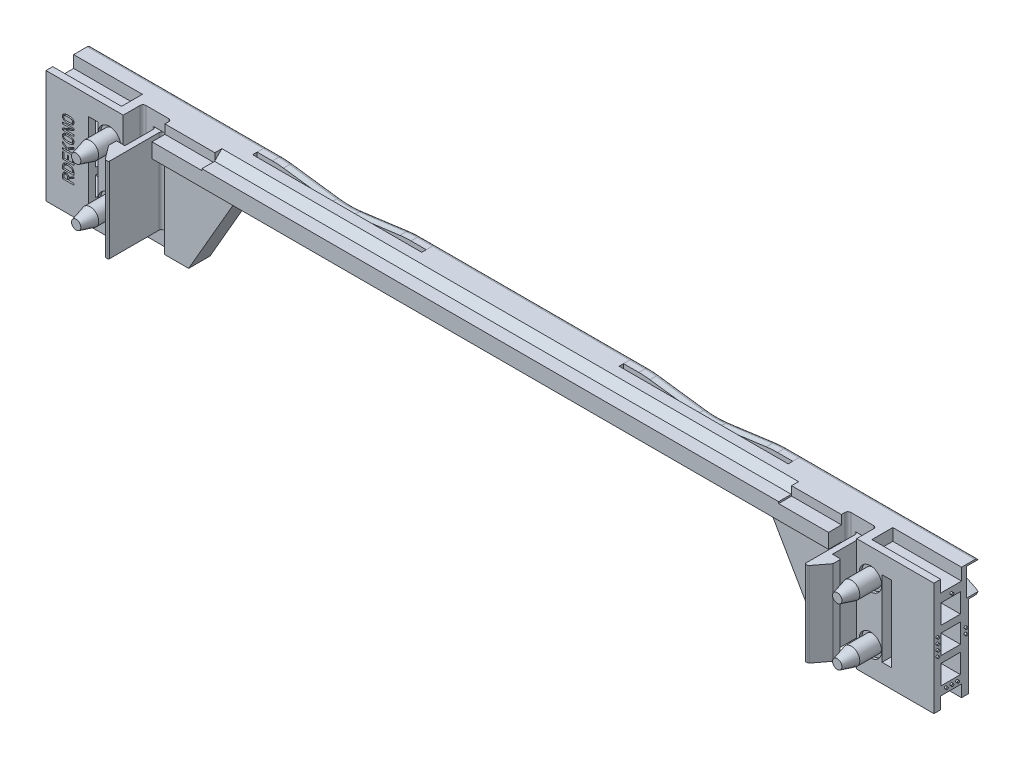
SolidWorks part; units mm, degrees
ref_plane "前视基准面" through (0, 0, 0) normal (0, 0, 1) x (1, 0, 0)
ref_plane "上视基准面" through (0, 0, 0) normal (0, 1, 0) x (1, 0, 0)
ref_plane "右视基准面" through (0, 0, 0) normal (1, 0, 0) x (0, 0, -1)
sketch "草图1" plane through (0, 0, 0) normal (0, 0, 1) x (1, 0, 0)
  line L0 (-47.35, 4.525) -> (47.35, 4.525)
  line L1 (-78.75, 10.025) -> (78.75, 10.025)
  line L2 (-78.75, 10.025) -> (-78.75, -10.025)
  line L3 (-78.75, -10.025) -> (-55.75, -10.025)
  line L4 (78.75, 10.025) -> (78.75, -10.025)
  line L5 (-78.75, 10.025) -> (78.75, -10.025) construction
  line L6 (-78.75, -10.025) -> (78.75, 10.025) construction
  line L7 (-47.35, 4.525) -> (-55.75, -10.025)
  line L8 (47.35, 4.525) -> (55.75, -10.025)
  line L9 (55.75, -10.025) -> (78.75, -10.025)
  point P0 (0, 0)
  point P8 (0, 4.525)
  dimension "D1" = 157.5
  dimension "D2" = 20.05
  dimension "D3" = 5.5
  dimension "D4" = 23
  dimension "D5" = 31.4
extrude "凸台-拉伸1" add sketch "草图1" along normal mid plane 6.1
sketch "草图2" plane through (0, -10.025, 0) normal (0, -1, 0) x (1, 0, 0)
  line L0 (-47.35, 3.05) -> (47.35, 3.05) construction
  line L1 (-65.05, 3.05) -> (65.05, 3.05)
  line L2 (-78.75, -3.05) -> (-55.75, -3.05) construction
  line L3 (-60, 0.75) -> (60, 0.75)
  line L5 (60, 0.75) -> (60, 0.05)
  line L6 (60.5, -0.45) -> (64.55, -0.45)
  line L7 (65.05, 0.05) -> (65.05, 3.05)
  line L8 (55.75, 3.05) -> (78.75, 3.05) construction
  line L9 (-60, 0.75) -> (-60, 0.05)
  line L10 (-60.5, -0.45) -> (-64.55, -0.45)
  line L11 (-65.05, 0.05) -> (-65.05, 3.05)
  line L12 (-78.75, 3.05) -> (-55.75, 3.05) construction
  line L13 (78.75, 3.05) -> (78.75, -3.05) construction
  line L15 (-47.35, -3.05) -> (47.35, -3.05) construction
  arc A0 (-60, 0.05) -> (-60.5, -0.45) centre (-60.5, 0.05) cw
  arc A1 (-64.55, -0.45) -> (-65.05, 0.05) centre (-64.55, 0.05) cw
  arc A2 (64.55, -0.45) -> (65.05, 0.05) centre (64.55, 0.05) ccw
  arc A3 (60, 0.05) -> (60.5, -0.45) centre (60.5, 0.05) ccw
  point P6 (0, 0.75)
  point P22 (-60, -0.45)
  point P25 (-65.05, -0.45)
  dimension "D7" = 0.5
  dimension "D8" = 0.5
  dimension "D1" = 3.8
  dimension "D2" = 13.7
  dimension "D3" = 120
  dimension "D6" = 2.6
extrude "切除-拉伸1" cut sketch "草图2" against normal through all
ref_plane "基准面1" through (0, -7.525, 0) normal (0, -1, 0) x (-1, 0, 0)
sketch "草图3" plane through (0, -7.525, 0) normal (0, -1, 0) x (-1, 0, 0)
  line L0 (61.75, 0.45) -> (62.75, 0.45)
  line L1 (64.55, 0.45) -> (60.5, 0.45) construction
  line L2 (62.75, 0.45) -> (62.75, -5.05)
  line L3 (62.75, -5.05) -> (64.25, -5.05)
  line L4 (64.25, -5.05) -> (64.25, -6.45)
  line L5 (64.25, -6.45) -> (62.35, -8.95)
  line L6 (62.35, -8.95) -> (61.75, -8.95)
  line L7 (61.75, -8.95) -> (61.75, 0.45)
  line L9 (78.75, 3.05) -> (55.75, 3.05) construction
  line L10 (0, 0) -> (0, -11.725) construction
  line L11 (-61.75, -8.95) -> (-61.75, 0.45)
  line L12 (-62.35, -8.95) -> (-61.75, -8.95)
  line L13 (-64.25, -6.45) -> (-62.35, -8.95)
  line L14 (-64.25, -5.05) -> (-64.25, -6.45)
  line L15 (-62.75, -5.05) -> (-64.25, -5.05)
  line L16 (-62.75, 0.45) -> (-62.75, -5.05)
  line L17 (-61.75, 0.45) -> (-62.75, 0.45)
  line L18 (65.05, -3.05) -> (78.75, -3.05) construction
  line L19 (78.75, -3.05) -> (78.75, 3.05) construction
  dimension "D1" = 1
  dimension "D2" = 14.5
  dimension "D3" = 12
  dimension "D4" = 2
  dimension "D5" = 2.5
  dimension "D6" = 9.5
  dimension "D7" = 0.6
extrude "凸台-拉伸2" add sketch "草图3" against normal blind 15
sketch "草图4" plane through (0, 0, 0.75) normal (0, 0, 1) x (1, 0, 0)
  line L0 (-60, 10.025) -> (60, 10.025) construction
  line L1 (-60, 8.725) -> (60, 8.725)
  line L2 (-60, 8.725) -> (-60, 5.825)
  line L3 (-60, 5.825) -> (60, 5.825)
  line L4 (60, 8.725) -> (60, 5.825)
  line L5 (-60, 8.725) -> (60, 5.825) construction
  line L6 (-60, 5.825) -> (60, 8.725) construction
  line L8 (-60, 10.025) -> (-60, -10.025) construction
  point P0 (0, 7.275)
  dimension "D1" = 2.9
  dimension "D2" = 1.3
extrude "凸台-拉伸3" add sketch "草图4" along normal blind 2.25
chamfer "倒角6" distance 1.3 angle 45 1 edges at (0, 4.525, 0.75)
sketch "草图17" plane through (0, 0, 3) normal (0, 0, 1) x (1, 0, 0)
  line L0 (60, 10.025) -> (60, -10.025) construction
  line L1 (60, 8.425) -> (51.15, 8.425)
  line L2 (60, 8.425) -> (60, 10.025)
  line L3 (60, 10.025) -> (51.15, 10.025)
  line L4 (51.15, 8.425) -> (51.15, 10.025)
  line L5 (-60, 10.025) -> (60, 10.025) construction
  line L6 (0, 8.725) -> (0, 15.7989) construction
  line L7 (60, 8.725) -> (-60, 8.725) construction
  line L8 (-51.15, 8.425) -> (-51.15, 10.025)
  line L9 (-60, 10.025) -> (-51.15, 10.025)
  line L10 (-60, 8.425) -> (-60, 10.025)
  line L11 (-60, 8.425) -> (-51.15, 8.425)
  dimension "D1" = 102.3
  dimension "D2" = 1.6
extrude "切除-拉伸10" cut sketch "草图17" against normal blind 2.3
sketch "草图18" plane through (51.15, 0, 0) normal (1, 0, 0) x (0, 0, -1)
  line L0 (-0.75, 10.025) -> (-0.75, 8.725)
  line L1 (-0.75, 8.725) -> (0.55, 10.025)
  line L2 (0.55, 10.025) -> (-0.75, 10.025)
extrude "切除-拉伸11" cut sketch "草图18" against normal up to surface (102.3 mm away)
sketch "草图10" plane through (0, 0, 3.05) normal (0, 0, 1) x (1, 0, 0)
  line L1 (78.75, -10.025) -> (78.75, 10.025) construction
  line L2 (0, 0) -> (0, -13.4841) construction
  circle A0 centre (67.5, 5.08) radius 1.5
  circle A1 centre (67.5, -5.08) radius 1.5
  circle A2 centre (-67.5, -5.08) radius 1.5
  circle A3 centre (-67.5, 5.08) radius 1.5
  point P4 (78.75, 0)
  dimension "D1" = 10.16
  dimension "D2" = 5.08
  dimension "D3" = 3
  dimension "D4" = 135
extrude "凸台-拉伸4" add sketch "草图10" along normal blind 5.9
sketch "草图19" plane through (0, 0, 3.05) normal (0, 0, 1) x (1, 0, 0)
  circle A0 centre (67.5, 5.08) radius 2
  circle A1 centre (67.5, -5.08) radius 2
  circle A2 centre (-67.5, 5.08) radius 2
  circle A3 centre (-67.5, -5.08) radius 2
  circle A4 centre (-67.5, -5.08) radius 1.5
  circle A5 centre (-67.5, 5.08) radius 1.5
  circle A6 centre (67.5, 5.08) radius 1.5
  circle A7 centre (67.5, -5.08) radius 1.5
  dimension "D1" = 3
  dimension "D2" = 4
extrude "切除-拉伸12" cut sketch "草图19" against normal blind 0.5
chamfer "倒角7" distance 2.5 angle 15 4 edges at (-69, 5.08, 8.95) (69, 5.08, 8.95) (69, -5.08, 8.95) (-69, -5.08, 8.95)
sketch "草图12" plane through (-78.75, 0, 0) normal (-1, 0, 0) x (0, 0, 1)
  line L0 (3.05, 10.025) -> (-3.05, 10.025) construction
  line L1 (-1.85, 10.025) -> (1.85, 10.025)
  line L2 (-1.85, 10.025) -> (-1.85, 7.9)
  line L3 (-1.85, 7.9) -> (1.85, 7.9)
  line L4 (1.85, 10.025) -> (1.85, 7.9)
  line L5 (3.05, -10.025) -> (-3.05, -10.025) construction
  line L6 (-1.85, -10.025) -> (1.85, -10.025)
  line L7 (-1.85, -10.025) -> (-1.85, -7.9)
  line L8 (-1.85, -7.9) -> (1.85, -7.9)
  line L9 (1.85, -10.025) -> (1.85, -7.9)
  line L10 (-3.05, 10.025) -> (-3.05, -10.025) construction
  line L11 (3.05, 10.025) -> (3.05, -10.025) construction
  dimension "D1" = 15.8
  dimension "D2" = 1.2
  dimension "D5" = 1.2
extrude "切除-拉伸7" cut sketch "草图12" against normal blind 12.2
sketch "草图13" plane through (-78.75, 0, 0) normal (-1, 0, 0) x (0, 0, 1)
  line L0 (-1.85, 10.025) -> (-1.85, 7.9) construction
  line L1 (-1.85, 6.375) -> (1.6, 6.375)
  line L2 (-1.85, 6.375) -> (-1.85, 2.925)
  line L3 (-1.85, 2.925) -> (1.6, 2.925)
  line L4 (1.6, 6.375) -> (1.6, 2.925)
  line L5 (-1.85, 6.375) -> (1.6, 2.925) construction
  line L6 (-1.85, 2.925) -> (1.6, 6.375) construction
  line L8 (-1.85, 1.725) -> (-1.85, -1.725)
  line L9 (-1.85, 1.725) -> (1.6, 1.725)
  line L10 (-1.85, -1.725) -> (1.6, -1.725)
  line L11 (1.6, 1.725) -> (1.6, -1.725)
  line L12 (-1.85, -2.925) -> (-1.85, -6.375)
  line L13 (-1.85, -2.925) -> (1.6, -2.925)
  line L14 (-1.85, -6.375) -> (1.6, -6.375)
  line L15 (1.6, -2.925) -> (1.6, -6.375)
  point P0 (-0.125, 4.65)
  point P7 (1.6, 0)
  dimension "D1" = 3.45
  dimension "D2" = 3.45
  dimension "D4" = 4.65
  dimension "D3" = 3
extrude "切除-拉伸8" cut sketch "草图13" against normal blind 7.8
sketch "草图30" plane through (0, 0, -3.05) normal (0, 0, -1) x (-1, 0, 0)
  line L0 (-78.75, -10.025) -> (-78.75, 10.025) construction
  line L1 (78.75, 10.025) -> (-78.75, 10.025)
  line L2 (78.75, 10.025) -> (78.75, 4.525)
  line L3 (78.75, 4.525) -> (-78.75, 4.525)
  line L4 (-78.75, 10.025) -> (-78.75, 4.525)
  line L5 (47.35, 4.525) -> (-47.35, 4.525) construction
extrude "切除-拉伸16" cut sketch "草图30" against normal blind 0.3
sketch "草图14" plane through (0, 0, -2.75) normal (0, 0, -1) x (-1, 0, 0)
  line L0 (78.75, 4.525) -> (78.75, -10.025) construction
  line L1 (-78.75, 10.025) -> (78.75, 10.025)
  line L2 (-78.75, 10.025) -> (-78.75, 8.725)
  line L3 (-78.75, 8.725) -> (78.75, 8.725)
  line L4 (78.75, 10.025) -> (78.75, 8.725)
  line L5 (-78.75, -10.025) -> (-78.75, 4.525) construction
  line L6 (-78.75, 5.825) -> (78.75, 5.825)
  line L7 (-78.75, 5.825) -> (-78.75, 4.525)
  line L8 (-78.75, 4.525) -> (78.75, 4.525)
  line L9 (78.75, 5.825) -> (78.75, 4.525)
  line L10 (47.35, 4.525) -> (-47.35, 4.525) construction
  line L13 (78.75, 4.525) -> (78.75, 10.025) construction
  line L14 (78.75, 10.025) -> (-78.75, 10.025) construction
  dimension "D1" = 1.3
  dimension "D2" = 1.3
extrude "凸台-拉伸5" add sketch "草图14" along normal blind 2.1
fillet "圆角1" radius 0.6 2 edges at (0, 4.525, -4.85) (0, 10.025, -4.85)
sketch "草图15" plane through (0, 0, -4.85) normal (0, 0, -1) x (-1, 0, 0)
  line L0 (-78.75, 10.025) -> (78.75, 10.025) construction
  line L1 (-47.5, 10.025) -> (-17.5, 10.025)
  line L2 (-47.5, 10.025) -> (-47.5, 8.725)
  line L3 (-47.5, 8.725) -> (-17.5, 8.725)
  line L4 (-17.5, 10.025) -> (-17.5, 8.725)
  line L5 (-47.5, 10.025) -> (-17.5, 8.725) construction
  line L6 (-47.5, 8.725) -> (-17.5, 10.025) construction
  line L7 (-78.75, 8.725) -> (78.75, 8.725) construction
  line L9 (17.5, 8.725) -> (47.5, 8.725)
  line L10 (17.5, 8.725) -> (17.5, 10.025)
  line L11 (17.5, 10.025) -> (47.5, 10.025)
  line L12 (47.5, 8.725) -> (47.5, 10.025)
  line L13 (17.5, 8.725) -> (47.5, 10.025) construction
  line L14 (17.5, 10.025) -> (47.5, 8.725) construction
  point P0 (-32.5, 9.375)
  point P10 (32.5, 9.375)
  dimension "D1" = 30
  dimension "D2" = 17.5
  dimension "D3" = 17.5
extrude "切除-拉伸9" cut sketch "草图15" against normal blind 2.5
sketch "草图16" plane through (0, 0, -4.85) normal (0, 0, -1) x (-1, 0, 0)
  line L0 (-44.7912, 10.025) -> (-47.5, 10.025)
  line L1 (-17.5, 10.025) -> (-47.5, 10.025) construction
  line L2 (-47.5, 10.025) -> (-47.5, 8.725)
  line L3 (-47.5, 8.725) -> (-44.9741, 8.725)
  line L4 (-47.5, 8.725) -> (-17.5, 8.725) construction
  line L5 (-20.2088, 10.025) -> (-17.5, 10.025)
  line L6 (-17.5, 10.025) -> (-17.5, 8.725)
  line L7 (-17.5, 8.725) -> (-20.0259, 8.725)
  line L8 (-22.1826, 9.8946) -> (-30.5262, 8.787)
  line L9 (-34.4738, 8.787) -> (-42.8174, 9.8946)
  line L11 (78.75, 4.525) -> (-78.75, 4.525) construction
  line L12 (-43.034, 8.599) -> (-34.4401, 7.4781)
  line L13 (-30.5599, 7.4781) -> (-21.966, 8.599)
  line L14 (0, 0) -> (0, -16.4806) construction
  line L15 (30.5599, 7.4781) -> (21.966, 8.599)
  line L16 (43.034, 8.599) -> (34.4401, 7.4781)
  line L17 (34.4738, 8.787) -> (42.8174, 9.8946)
  line L18 (22.1826, 9.8946) -> (30.5262, 8.787)
  line L19 (17.5, 8.725) -> (20.0259, 8.725)
  line L20 (17.5, 10.025) -> (17.5, 8.725)
  line L21 (20.2088, 10.025) -> (17.5, 10.025)
  line L22 (47.5, 8.725) -> (44.9741, 8.725)
  line L23 (47.5, 10.025) -> (47.5, 8.725)
  line L24 (44.7912, 10.025) -> (47.5, 10.025)
  arc A0 (-20.0259, 8.725) -> (-21.966, 8.599) centre (-20.0259, -6.275) ccw
  arc A1 (-20.2088, 10.025) -> (-22.1826, 9.8946) centre (-20.2088, -4.975) ccw
  arc A2 (-30.5599, 7.4781) -> (-34.4401, 7.4781) centre (-32.5, 22.3521) cw
  arc A3 (-30.5262, 8.787) -> (-34.4738, 8.787) centre (-32.5, 23.6566) cw
  arc A4 (-43.034, 8.599) -> (-44.9741, 8.725) centre (-44.9741, -6.275) ccw
  arc A5 (-42.8174, 9.8946) -> (-44.7912, 10.025) centre (-44.7912, -4.975) ccw
  arc A6 (42.8174, 9.8946) -> (44.7912, 10.025) centre (44.7912, -4.975) cw
  arc A7 (43.034, 8.599) -> (44.9741, 8.725) centre (44.9741, -6.275) cw
  arc A8 (30.5262, 8.787) -> (34.4738, 8.787) centre (32.5, 23.6566) ccw
  arc A9 (30.5599, 7.4781) -> (34.4401, 7.4781) centre (32.5, 22.3521) ccw
  arc A10 (20.2088, 10.025) -> (22.1826, 9.8946) centre (20.2088, -4.975) cw
  arc A11 (20.0259, 8.725) -> (21.966, 8.599) centre (20.0259, -6.275) cw
  point P22 (-21, 8.725)
  point P25 (-21.2, 10.025)
  point P28 (-32.5, 7.225)
  point P31 (-32.5, 8.525)
  point P34 (-44, 8.725)
  point P37 (-43.8, 10.025)
  point P63 (43.8, 10.025)
  point P64 (44, 8.725)
  point P65 (32.5, 8.525)
  point P66 (32.5, 7.225)
  point P67 (21.2, 10.025)
  point P68 (21, 8.725)
  dimension "D5" = 15
  dimension "D1" = 3.7
  dimension "D2" = 3.5
  dimension "D3" = 4
  dimension "D4" = 1.3
extrude "凸台-拉伸10" add sketch "草图16" against normal blind 1.7 separate body
fillet "圆角2" radius 0.6 7 edges at (46.1456, 10.025, -4.85) (43.8022, 9.9924, -4.85) (38.6456, 9.3408, -4.85) (32.5, 8.6566, -4.85) (26.3544, 9.3408, -4.85) (21.1978, 9.9924, -4.85) (18.8544, 10.025, -4.85)
fillet "圆角3" radius 0.6 7 edges at (-18.8544, 10.025, -4.85) (-21.1978, 9.9924, -4.85) (-26.3544, 9.3408, -4.85) (-32.5, 8.6566, -4.85) (-38.6456, 9.3408, -4.85) (-43.8022, 9.9924, -4.85) (-46.1456, 10.025, -4.85)
sketch "草图20" plane through (0, 0, 3.05) normal (0, 0, 1) x (1, 0, 0)
  line L0 (-78.75, -1.725) -> (-78.75, 1.725) construction
  line L1 (-71.25, 6.725) -> (-69.55, 6.725)
  line L2 (-71.25, 6.725) -> (-71.25, -6.725)
  line L3 (-71.25, -6.725) -> (-69.55, -6.725)
  line L4 (-69.55, 6.725) -> (-69.55, -6.725)
  line L5 (-65.05, 10.025) -> (-78.75, 10.025) construction
  line L6 (-78.75, -10.025) -> (-65.05, -10.025) construction
  point P4 (-78.75, 0)
  dimension "D1" = 7.5
  dimension "D2" = 3.3
  dimension "D3" = 3.3
  dimension "D4" = 1.7
extrude "切除-拉伸13" cut sketch "草图20" against normal blind 5.2
sketch "草图21" plane through (-78.75, 0, 0) normal (-1, 0, 0) x (0, 0, 1)
  circle A0 centre (0, 7) radius 0.2
  circle A1 centre (-1, 7) radius 0.2
  circle A2 centre (1, 7) radius 0.2
  circle A3 centre (-2.5, -0.5) radius 0.2
  circle A4 centre (-2.5, 0.5) radius 0.2
  circle A5 centre (0, -7) radius 0.2
  circle A6 centre (2.5, -1.5) radius 0.2
  circle A7 centre (2.5, -0.5) radius 0.2
  circle A8 centre (2.5, 0.5) radius 0.2
  circle A9 centre (2.5, 1.5) radius 0.2
  dimension "D2" = 0.4
  dimension "D3" = 1
  dimension "D4" = 0.5
  dimension "D6" = 1
  dimension "D7" = 2.5
  dimension "D8" = 7
  dimension "D9" = 1
  dimension "D10" = 1
  dimension "D1" = 2.5
  dimension "D5" = 1
  dimension "D11" = 7
extrude "凸台-拉伸11" add sketch "草图21" along normal blind 0.3
mirror "镜向1" about plane through (0, 0, 0) normal (1, 0, 0) of "切除-拉伸8"
mirror "镜向2" about plane through (0, 0, 0) normal (1, 0, 0) of "切除-拉伸7"
mirror "镜向3" about plane through (0, 0, 0) normal (1, 0, 0) of "切除-拉伸13"
sketch "草图22" plane through (78.75, 0, 0) normal (1, 0, 0) x (0, 0, -1)
  circle A0 centre (2.5, 0.5) radius 0.2
  circle A1 centre (2.5, -0.5) radius 0.2
  circle A2 centre (-2.5, 1.5) radius 0.2
  circle A3 centre (-2.5, 0.5) radius 0.2
  circle A4 centre (-2.5, -0.5) radius 0.2
  circle A5 centre (-2.5, -1.5) radius 0.2
  circle A6 centre (0, 7) radius 0.2
  circle A7 centre (1, -7) radius 0.2
  circle A8 centre (0, -7) radius 0.2
  circle A9 centre (-1, -7) radius 0.2
  dimension "D3" = 1
  dimension "D5" = 1
  dimension "D6" = 1
  dimension "D7" = 0.4
  dimension "D8" = 7
  dimension "D9" = 1
  dimension "D10" = 1
  dimension "D11" = 7
  dimension "D1" = 2.5
  dimension "D2" = 2.5
  dimension "D4" = 0.5
extrude "凸台-拉伸12" add sketch "草图22" along normal blind 0.3
fillet "圆角5" radius 0.5 4 edges at (-61.75, -0.025, -0.45) (-62.75, -0.025, -0.45) (62.75, -0.025, -0.45) (61.75, -0.025, -0.45)
sketch "草图23" plane through (0, 0, -3.05) normal (0, 0, -1) x (-1, 0, 0)
  line L0 (74.75, 3.525) -> (74.75, -5.4165) construction
  line L1 (78.75, 4.525) -> (78.75, -10.025) construction
  line L2 (78.75, 4.525) -> (47.35, 4.525) construction
  line L3 (-77.35, 4.025) -> (-77.35, -5.6454) construction
  line L4 (-78.75, -10.025) -> (-78.75, 4.525) construction
  line L5 (-78.75, 10.025) -> (-47.5, 10.025) construction
  text T0 "AB  C" font "黑体" height 2.5
  text T1 "DE  F" font "黑体" height 2.5
  dimension "D1" = 4
  dimension "D2" = 1
  dimension "D3" = 1.4
  dimension "D4" = 6
extrude "凸台-拉伸13" add sketch "草图23" along normal blind 0.2
sketch "草图24" plane through (0, 0, 3) normal (0, 0, 1) x (1, 0, 0)
  line L0 (55, 7.875) -> (30.425, 7.875) construction
  line L1 (60, 5.825) -> (60, 8.425) construction
  text T0 "RDEKONO-F-160" font "黑体" height 1.5
  point P3 (60, 7.125)
  dimension "D1" = 0.75
  dimension "D2" = 5
extrude "凸台-拉伸14" [suppressed] add sketch "草图24" along normal blind 0.2
fillet "圆角6" radius 0.2 8 edges at (64.25, -0.025, 5.05) (64.25, -0.025, 6.45) (62.35, -0.025, 8.95) (61.75, -0.025, 8.95) (-64.25, -0.025, 5.05) (-64.25, -0.025, 6.45) (-61.75, -0.025, 8.95) (-62.35, -0.025, 8.95)
sketch "草图25" plane through (-78.75, 0, 0) normal (-1, 0, 0) x (0, 0, 1)
  line L0 (-1.85, 2.925) -> (1.6, 2.925) construction
  line L1 (1.6, 6.375) -> (1.8, 6.375)
  line L2 (1.6, 6.375) -> (1.6, 2.925)
  line L3 (1.6, 2.925) -> (1.8, 2.925)
  line L4 (1.8, 6.375) -> (1.8, 2.925)
  line L5 (-1.85, -1.725) -> (1.6, -1.725) construction
  line L6 (1.6, 1.725) -> (1.8, 1.725)
  line L7 (1.6, 1.725) -> (1.6, -1.725)
  line L8 (1.6, -1.725) -> (1.8, -1.725)
  line L9 (1.8, 1.725) -> (1.8, -1.725)
  line L10 (-1.85, -6.375) -> (1.6, -6.375) construction
  line L11 (1.6, -2.925) -> (1.8, -2.925)
  line L12 (1.6, -2.925) -> (1.6, -6.375)
  line L13 (1.6, -6.375) -> (1.8, -6.375)
  line L14 (1.8, -2.925) -> (1.8, -6.375)
  dimension "D1" = 0.2
  dimension "D2" = 0.2
  dimension "D3" = 0.2
extrude "切除-拉伸14" cut sketch "草图25" against normal up to surface (9.2 mm away)
sketch "草图26" plane through (-78.75, 0, 0) normal (-1, 0, 0) x (0, 0, 1)
  line L0 (-1.85, 2.925) -> (1.8, 2.925) construction
  line L1 (-1.85, 6.375) -> (-1.65, 6.375)
  line L2 (-1.85, 6.375) -> (-1.85, 2.925)
  line L3 (-1.85, 2.925) -> (-1.65, 2.925)
  line L4 (-1.65, 6.375) -> (-1.65, 2.925)
  line L5 (-1.85, -1.725) -> (1.8, -1.725) construction
  line L6 (-1.85, 1.725) -> (-1.65, 1.725)
  line L7 (-1.85, 1.725) -> (-1.85, -1.725)
  line L8 (-1.85, -1.725) -> (-1.65, -1.725)
  line L9 (-1.65, 1.725) -> (-1.65, -1.725)
  line L10 (-1.85, -6.375) -> (1.8, -6.375) construction
  line L11 (-1.85, -2.925) -> (-1.65, -2.925)
  line L12 (-1.85, -2.925) -> (-1.85, -6.375)
  line L13 (-1.85, -6.375) -> (-1.65, -6.375)
  line L14 (-1.65, -2.925) -> (-1.65, -6.375)
  dimension "D1" = 0.2
  dimension "D2" = 0.2
  dimension "D3" = 0.2
extrude "凸台-拉伸15" add sketch "草图26" against normal up to surface (7.5 mm away)
sketch "草图27" plane through (78.75, 0, 0) normal (1, 0, 0) x (0, 0, -1)
  line L1 (1.85, 2.925) -> (-1.6, 2.925) construction
  line L2 (-1.6, 6.375) -> (-1.8, 6.375)
  line L3 (-1.6, 6.375) -> (-1.6, 2.925)
  line L4 (-1.6, 2.925) -> (-1.8, 2.925)
  line L5 (-1.8, 6.375) -> (-1.8, 2.925)
  line L6 (-1.6, 1.725) -> (-1.8, 1.725)
  line L7 (-1.6, 1.725) -> (-1.6, -1.725)
  line L8 (-1.6, -1.725) -> (-1.8, -1.725)
  line L10 (-1.8, 1.725) -> (-1.8, -1.725)
  line L11 (-1.6, -2.925) -> (-1.8, -2.925)
  line L12 (-1.6, -2.925) -> (-1.6, -6.375)
  line L13 (-1.6, -6.375) -> (-1.8, -6.375)
  line L15 (-1.8, -2.925) -> (-1.8, -6.375)
  line L16 (1.85, -1.725) -> (-1.6, -1.725) construction
  line L17 (1.85, -6.375) -> (-1.6, -6.375) construction
  dimension "D1" = 0.2
  dimension "D2" = 0.2
  dimension "D3" = 0.2
extrude "切除-拉伸15" cut sketch "草图27" against normal up to surface (7.5 mm away)
sketch "草图28" plane through (78.75, 0, 0) normal (1, 0, 0) x (0, 0, -1)
  line L0 (1.85, 2.925) -> (-1.8, 2.925) construction
  line L1 (1.85, 6.375) -> (1.65, 6.375)
  line L2 (1.85, 6.375) -> (1.85, 2.925)
  line L3 (1.85, 2.925) -> (1.65, 2.925)
  line L4 (1.65, 6.375) -> (1.65, 2.925)
  line L5 (1.85, -1.725) -> (-1.8, -1.725) construction
  line L6 (1.85, 1.725) -> (1.65, 1.725)
  line L7 (1.85, 1.725) -> (1.85, -1.725)
  line L8 (1.85, -1.725) -> (1.65, -1.725)
  line L9 (1.65, 1.725) -> (1.65, -1.725)
  line L10 (1.85, -6.375) -> (-1.8, -6.375) construction
  line L11 (1.85, -2.925) -> (1.65, -2.925)
  line L12 (1.85, -2.925) -> (1.85, -6.375)
  line L13 (1.85, -6.375) -> (1.65, -6.375)
  line L14 (1.65, -2.925) -> (1.65, -6.375)
  dimension "D1" = 0.2
  dimension "D2" = 0.2
  dimension "D3" = 0.2
extrude "凸台-拉伸16" add sketch "草图28" against normal up to surface (7.5 mm away)
chamfer "倒角9" distance 1 distance2 2 4 edges at (-78.75, 5.825, -3.8) (-78.75, 8.725, -3.8) (78.75, 5.825, -3.8) (78.75, 8.725, -3.8)
sketch "草图31" plane through (0, 0, 3.05) normal (0, 0, 1) x (1, 0, 0)
  line L0 (-73.75, 10.025) -> (-73.75, -10.025) construction
  line L1 (-65.05, 10.025) -> (-78.75, 10.025) construction
  line L2 (-78.75, -10.025) -> (-65.05, -10.025) construction
  line L3 (-78.75, 10.025) -> (-78.75, -10.025) construction
  text T0 "RDEKONO" font "黑体" height 2
  dimension "D1" = 5
extrude "切除-拉伸17" cut sketch "草图31" against normal blind 0.3
equation "\"`5\"=0.5"
equation "\"`5.08\"=5.03"
